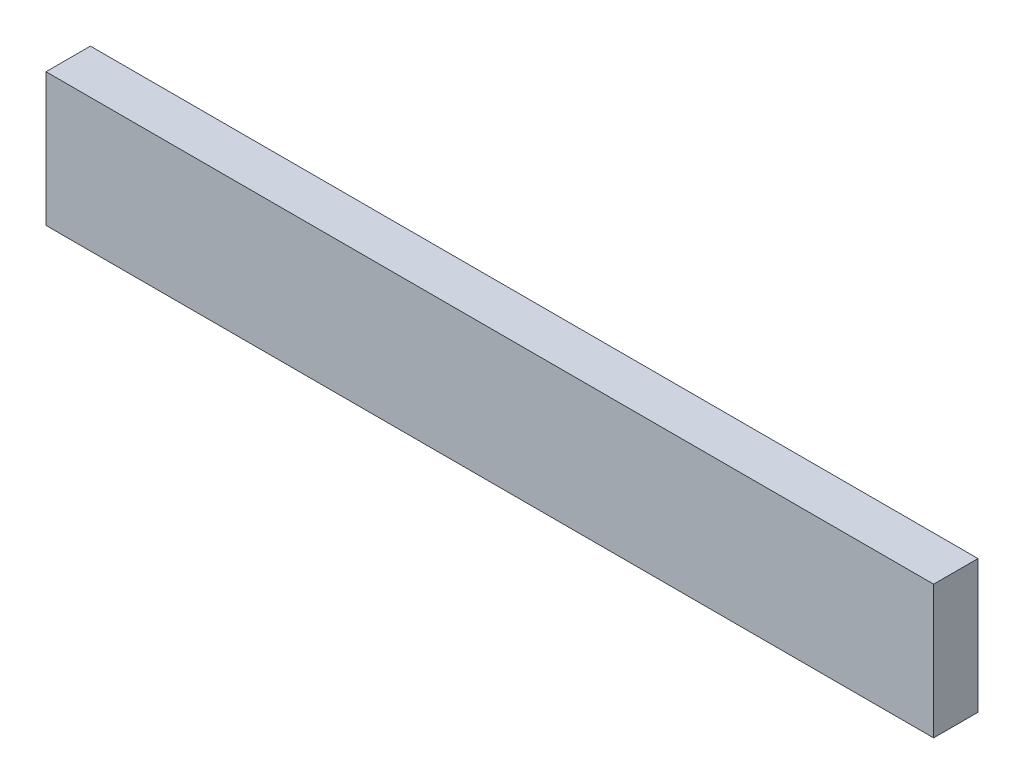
SolidWorks part; units mm, degrees
ref_plane "Front" through (0, 0, 0) normal (0, 0, 1) x (1, 0, 0)
ref_plane "Top" through (0, 0, 0) normal (0, 1, 0) x (1, 0, 0)
ref_plane "Right" through (0, 0, 0) normal (1, 0, 0) x (0, 0, -1)
sketch "Sketch1" plane through (0, 0, 0) normal (0, 0, 1) x (1, 0, 0)
  line L1 (0, 0) -> (200, 0)
  line L2 (0, 0) -> (0, 30)
  line L3 (0, 30) -> (200, 30)
  line L4 (200, 0) -> (200, 30)
  dimension "D1" = 200
  dimension "D2" = 30
extrude "Base-Extrude" add sketch "Sketch1" along normal blind 10
